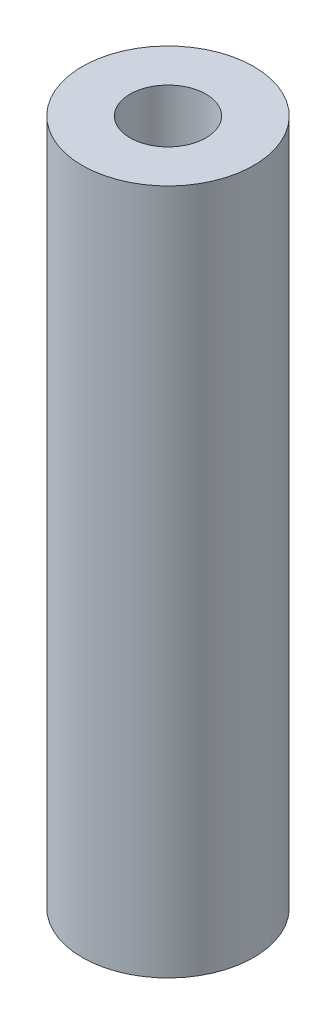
SolidWorks part; units mm, degrees
ref_plane "Front" through (0, 0, 0) normal (0, 0, 1) x (1, 0, 0)
ref_plane "Top" through (0, 0, 0) normal (0, 1, 0) x (1, 0, 0)
ref_plane "Right" through (0, 0, 0) normal (1, 0, 0) x (0, 0, -1)
sketch "Sketch1" plane through (0, 0, 0) normal (0, 1, 0) x (1, 0, 0)
  circle A0 centre (0, 0) radius 4.7625
  dimension "D1" = 9.525
extrude "Extrude1" add sketch "Sketch1" along normal blind 38.1
sketch "Sketch2" plane through (0, 0, 0) normal (0, 1, 0) x (1, 0, 0)
  circle A0 centre (0, 0) radius 2.1082
  dimension "D1" = 4.2164
extrude "Cut-Extrude2" cut sketch "Sketch2" along normal through all
